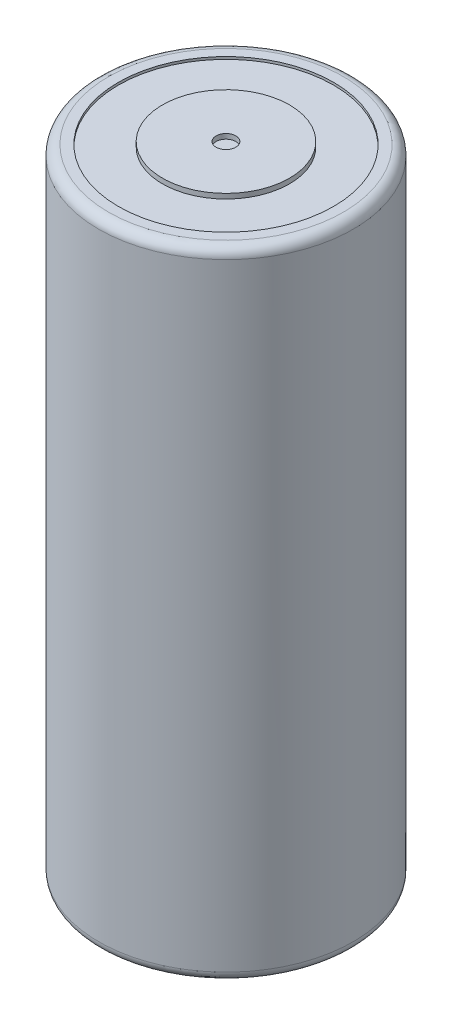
SolidWorks part; units mm, degrees
ref_plane "Front Plane" through (0, 0, 0) normal (0, 0, 1) x (1, 0, 0)
ref_plane "Top Plane" through (0, 0, 0) normal (0, 1, 0) x (1, 0, 0)
ref_plane "Right Plane" through (0, 0, 0) normal (1, 0, 0) x (0, 0, -1)
sketch "Sketch2" plane through (0, 0, 0) normal (0, 0, 1) x (1, 0, 0)
  line L0 (0, 0) -> (6.45, 0) construction
  line L1 (12.925, -0.25) -> (12.925, -64.9)
  line L2 (7.5, -65.15) -> (0, -65.15)
  line L3 (0, -65.15) -> (0, 0) construction
  line L4 (7.5, -64.65) -> (7.5, -65.15)
  line L5 (10.925, -64.65) -> (7.5, -64.65)
  line L6 (6.45, -0.5) -> (6.45, 0)
  line L7 (6.45, -0.5) -> (10.925, -0.5)
  line L8 (1, -0.5) -> (1, 0)
  line L9 (1, -0.5) -> (0, -0.5)
  line L10 (1, 0) -> (6.45, 0)
  line L11 (0, -65.15) -> (0, -0.5)
  line L12 (10.925, -0.5) -> (10.925, -0.25)
  line L13 (10.925, -64.65) -> (10.925, -64.9)
  line L14 (12.925, -0.25) -> (10.925, -0.25)
  line L15 (10.925, -64.9) -> (12.925, -64.9)
  dimension "D1" = 65.15
  dimension "D2" = 12.925
  dimension "D3" = 7.5
  dimension "D4" = 0.5
  dimension "D5" = 6.45
  dimension "D6" = 0.5
  dimension "D7" = 1
  dimension "D8" = 0.5
  dimension "D9" = 2
  dimension "D10" = 0.25
  dimension "D11" = 0.25
  dimension "D12" = 2
revolve "Revolve1" add sketch "Sketch2" angle 360 about L11
fillet "Fillet5" radius 1 2 edges at (0, -64.9, -12.925) (0, -0.25, -12.925)
